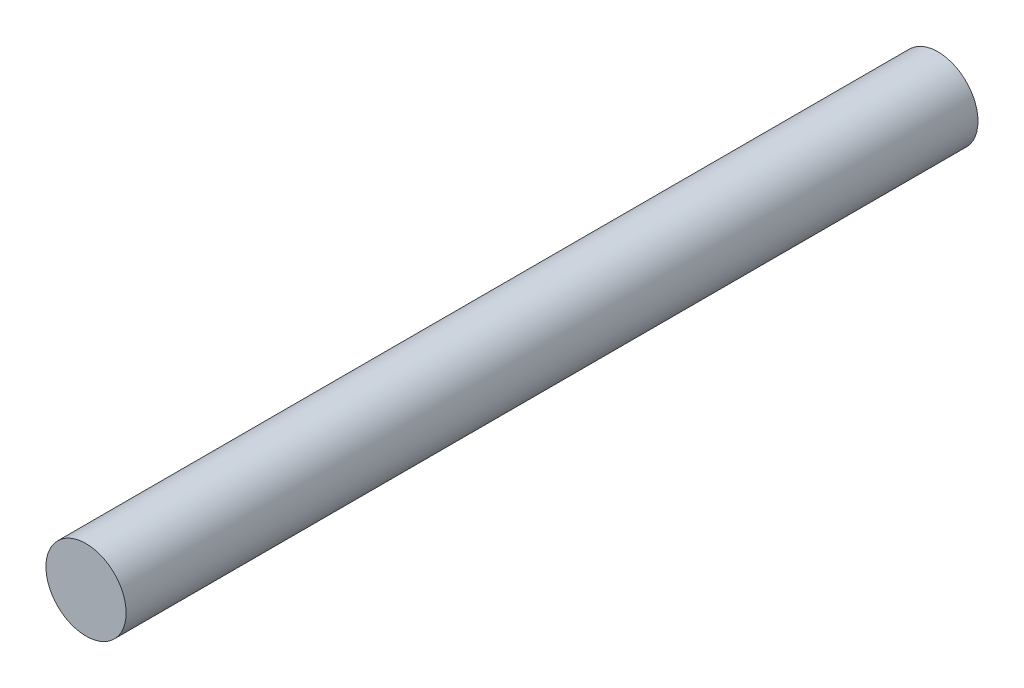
SolidWorks part; units mm, degrees
ref_plane "Face" through (0, 0, 0) normal (0, 0, 1) x (1, 0, 0)
ref_plane "Dessus" through (0, 0, 0) normal (0, 1, 0) x (1, 0, 0)
ref_plane "Droite" through (0, 0, 0) normal (1, 0, 0) x (0, 0, -1)
sketch "Esquisse1" plane through (0, 0, 0) normal (0, 0, 1) x (1, 0, 0)
  circle A0 centre (45, 0) radius 4
extrude "Base-Extrusion" add sketch "Esquisse1" against normal blind 85
